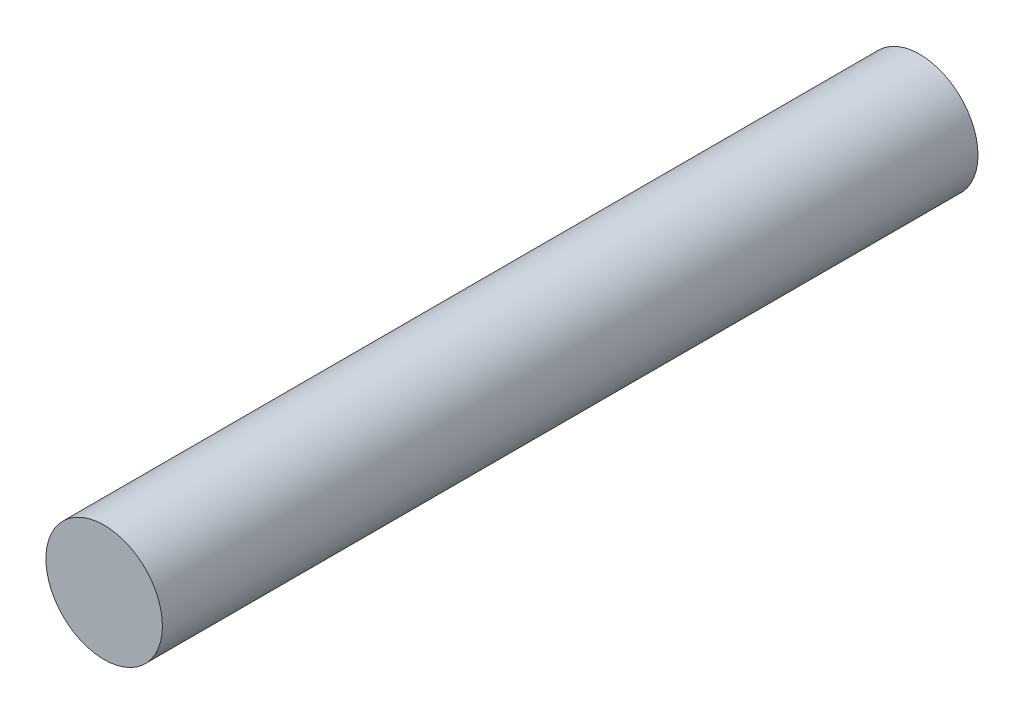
SolidWorks part; units mm, degrees
ref_plane "Face" through (0, 0, 0) normal (0, 0, 1) x (1, 0, 0)
ref_plane "Dessus" through (0, 0, 0) normal (0, 1, 0) x (1, 0, 0)
ref_plane "Droite" through (0, 0, 0) normal (1, 0, 0) x (0, 0, -1)
sketch "Esquisse1" plane through (0, 0, 0) normal (0, 0, 1) x (1, 0, 0)
  circle A0 centre (0, 0) radius 1
  dimension "D1" = 2
extrude "Boss.-Extru.1" add sketch "Esquisse1" along normal blind 14
